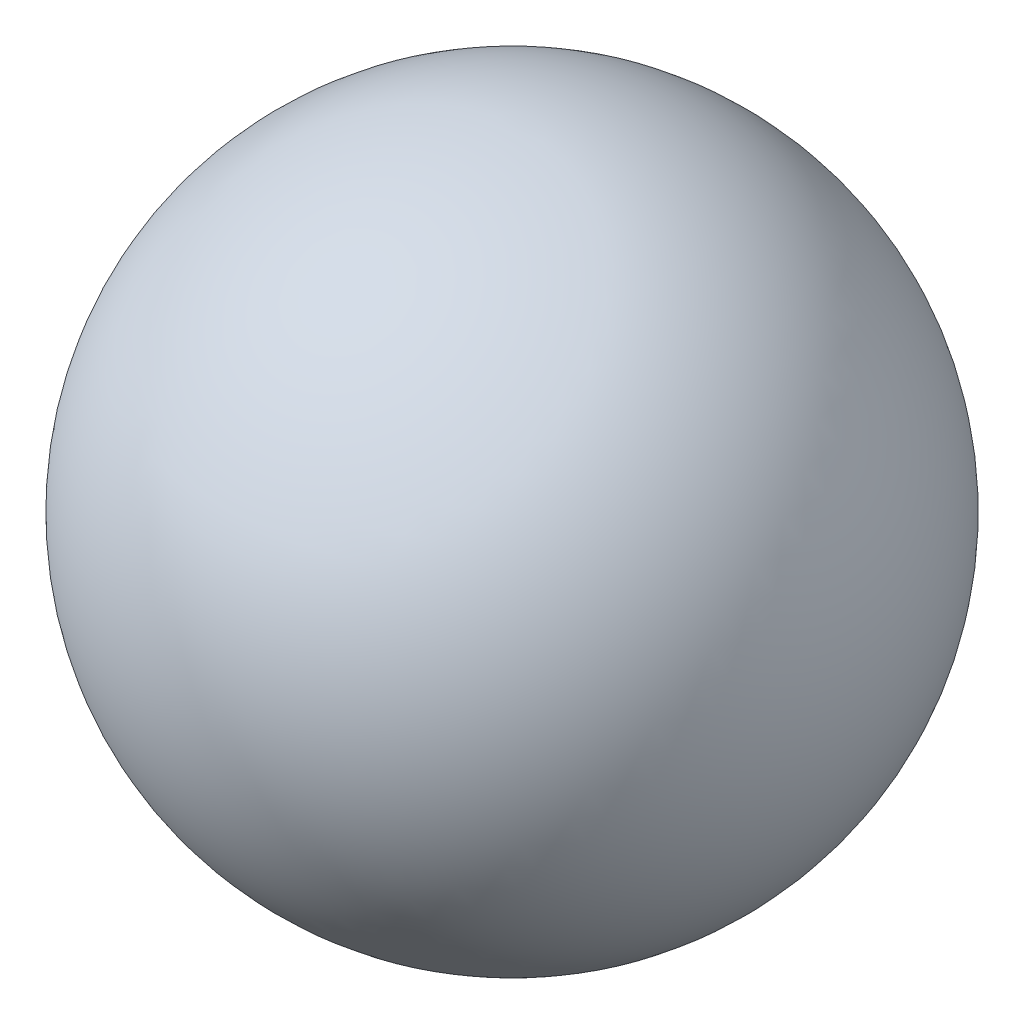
SolidWorks part; units mm, degrees
ref_plane "Plan1" through (0, 0, 0) normal (0, 0, 1) x (1, 0, 0)
ref_plane "Plan2" through (0, 0, 0) normal (0, 1, 0) x (1, 0, 0)
ref_plane "Plan3" through (0, 0, 0) normal (1, 0, 0) x (0, 0, -1)
sketch "Esquisse1" plane through (0, 0, 0) normal (0, 0, 1) x (1, 0, 0)
  line L1 (-1, 107.6735) -> (-1, 98.3304) construction
  line L2 (-1, 106) -> (-1, 100)
  arc A0 (-1, 106) -> (-1, 100) centre (-1, 103) ccw
  arc A1 (-3.5981, 101.5) -> (1.5981, 101.5) centre (-1, 103) ccw construction
revolve "Base-Révolution" add sketch "Esquisse1" angle 360 about L1
